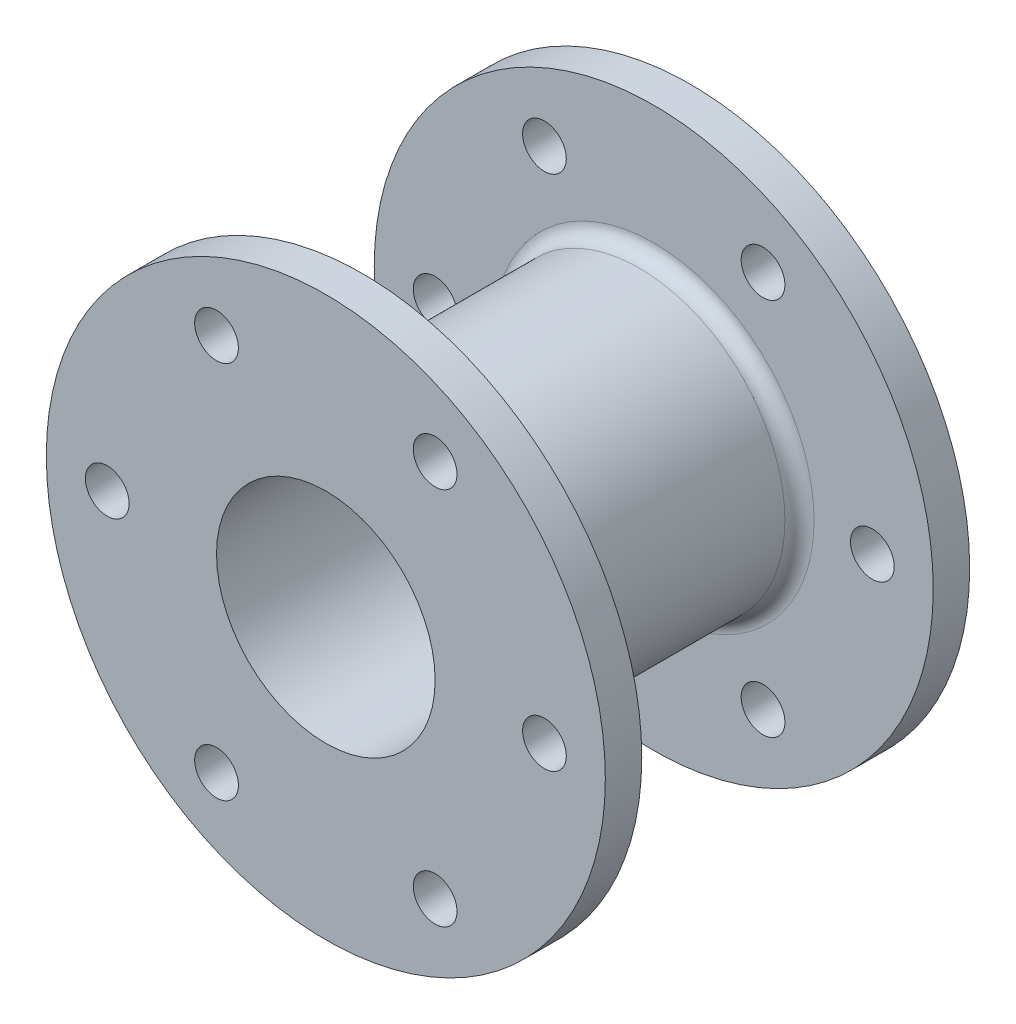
SolidWorks part; units mm, degrees
ref_plane "Front Plane" through (0, 0, 0) normal (0, 0, 1) x (1, 0, 0)
ref_plane "Top Plane" through (0, 0, 0) normal (0, 1, 0) x (1, 0, 0)
ref_plane "Right Plane" through (0, 0, 0) normal (1, 0, 0) x (0, 0, -1)
sketch "Sketch1" plane through (0, 0, 0) normal (0, 0, 1) x (1, 0, 0)
  circle A0 centre (0, 0) radius 38.3581
  circle A1 centre (0, 0) radius 30 construction
  circle A2 centre (-30, 0) radius 3
  circle A3 centre (-15, 25.9808) radius 3
  circle A4 centre (15, 25.9808) radius 3
  circle A5 centre (30, 0) radius 3
  circle A6 centre (15, -25.9808) radius 3
  circle A7 centre (-15, -25.9808) radius 3
  point P17 (0, 0)
  dimension "D1" = 6
extrude "Boss-Extrude1" add sketch "Sketch1" along normal blind 5
sketch "Sketch2" plane through (0, 0, 5) normal (0, 0, 1) x (1, 0, 0)
  circle A0 centre (0, 0) radius 20
  circle A1 centre (0, 0) radius 15
extrude "Boss-Extrude2" add sketch "Sketch2" along normal blind 45
sketch "Sketch3" plane through (0, 0, 5) normal (0, 0, 1) x (1, 0, 0)
  circle A1 centre (0, 0) radius 15
  circle A2 centre (0, 0) radius 15
  dimension "D1" = 0
extrude "Cut-Extrude1" cut sketch "Sketch3" against normal blind 50
sketch "Sketch4" plane through (0, 0, 50) normal (0, 0, 1) x (1, 0, 0)
  circle A1 centre (-15, -25.9808) radius 3 construction
  circle A2 centre (15, -25.9808) radius 3 construction
  circle A3 centre (30, 0) radius 3 construction
  circle A4 centre (15, 25.9808) radius 3 construction
  circle A5 centre (-15, 25.9808) radius 3 construction
  circle A6 centre (-30, 0) radius 3 construction
  circle A7 centre (-15, -25.9808) radius 3
  circle A8 centre (15, -25.9808) radius 3
  circle A9 centre (30, 0) radius 3
  circle A10 centre (15, 25.9808) radius 3
  circle A11 centre (-15, 25.9808) radius 3
  circle A12 centre (-30, 0) radius 3
  circle A13 centre (0, 0) radius 38.3581 construction
  circle A14 centre (0, 0) radius 38.3581
  circle A15 centre (0, 0) radius 15 construction
  circle A16 centre (0, 0) radius 15
extrude "Boss-Extrude3" add sketch "Sketch4" against normal blind 5
fillet "Fillet1" radius 2 2 edges at (20, 0, 45) (20, 0, 5)
